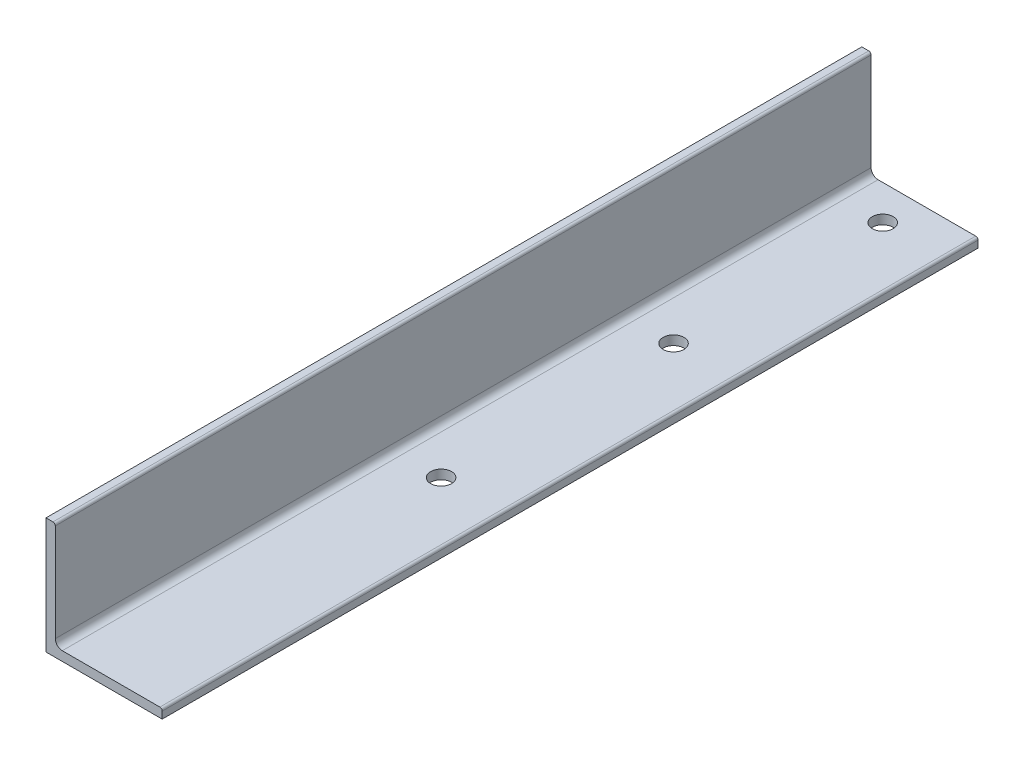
SolidWorks part; units mm, degrees
ref_plane "Front Plane" through (0, 0, 0) normal (0, 0, 1) x (1, 0, 0)
ref_plane "Top Plane" through (0, 0, 0) normal (0, 1, 0) x (1, 0, 0)
ref_plane "Right Plane" through (0, 0, 0) normal (1, 0, 0) x (0, 0, -1)
sketch "Sketch1" plane through (0, 0, 0) normal (0, 0, 1) x (1, 0, 0)
  line L0 (0, 100) -> (0, 0)
  line L1 (0, 0) -> (100, 0)
  line L2 (100, 0) -> (100, 6)
  line L3 (98, 8) -> (14, 8)
  line L4 (8, 14) -> (8, 98)
  line L5 (6, 100) -> (0, 100)
  arc A0 (14, 8) -> (8, 14) centre (14, 14) cw
  arc A1 (8, 98) -> (6, 100) centre (6, 98) ccw
  arc A2 (100, 6) -> (98, 8) centre (98, 6) ccw
  point P11 (8, 100)
  dimension "D3" = 6
  dimension "D4" = 2
  dimension "D1" = 100
  dimension "D2" = 8
extrude "Boss-Extrude1" add sketch "Sketch1" along normal blind 702
sketch "Sketch2" plane through (0, 8, 0) normal (0, 1, 0) x (1, 0, 0)
  line L0 (98, -702) -> (98, 0) construction
  line L1 (98, 0) -> (14, 0) construction
  circle A0 centre (48, -30) radius 9
  point P6 (0, 0)
  point P7 (0, 0)
  dimension "D1" = 50
  dimension "D2" = 18
  dimension "D3" = 30
extrude "Cut-Extrude1" cut sketch "Sketch2" against normal blind 8
pattern_linear "LPattern1" count 2 spacing 180 along (0, 0, 1) of "Cut-Extrude1"
pattern_linear "LPattern2" count 2 spacing 380 along (0, 0, 1) of "Cut-Extrude1"
